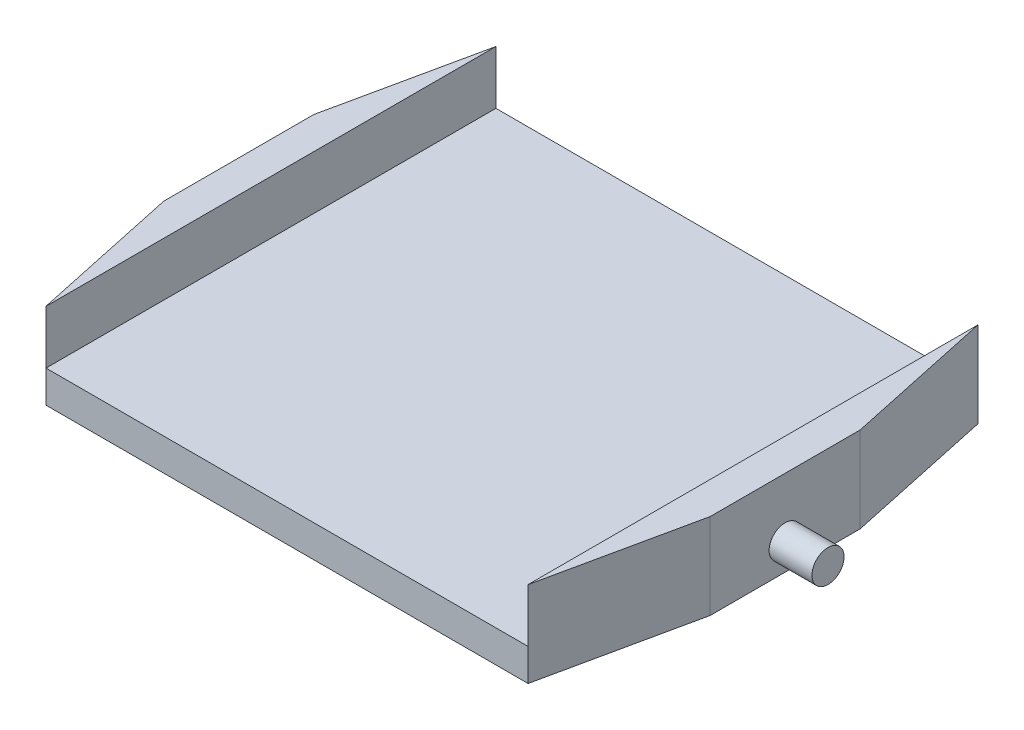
SolidWorks part; units mm, degrees
ref_plane "Front Plane" through (0, 0, 0) normal (0, 0, 1) x (1, 0, 0)
ref_plane "Top Plane" through (0, 0, 0) normal (0, 1, 0) x (1, 0, 0)
ref_plane "Right Plane" through (0, 0, 0) normal (1, 0, 0) x (0, 0, -1)
sketch "Sketch1" plane through (0, 0, 0) normal (0, 1, 0) x (1, 0, 0)
  line L0 (45, 0) -> (48, 14)
  line L1 (0, 0) -> (45, 0)
  line L2 (0, 0) -> (0, 42) construction
  line L3 (0, 42) -> (45, 42)
  line L4 (45, 0) -> (45, 42) construction
  line L5 (48, 14) -> (48, 28)
  line L6 (48, 28) -> (45, 42)
  line L7 (22.5, 42) -> (22.5, 0) construction
  line L8 (-3, 28) -> (0, 42)
  line L9 (-3, 14) -> (-3, 28)
  line L10 (0, 0) -> (-3, 14)
  dimension "D1" = 45
  dimension "D2" = 42
  dimension "D3" = 3
  dimension "D4" = 14
  dimension "D5" = 14
extrude "Boss-Extrude1" add sketch "Sketch1" along normal blind 3
sketch "Sketch2" plane through (0, 3, 0) normal (0, 1, 0) x (1, 0, 0)
  line L0 (0, 42) -> (0, 0)
  line L1 (0, 0) -> (-3, 14)
  line L2 (-3, 14) -> (-3, 28)
  line L3 (-3, 28) -> (0, 42)
  line L4 (45, 42) -> (45, 0)
  line L5 (45, 0) -> (48, 14)
  line L6 (48, 14) -> (48, 28)
  line L7 (48, 28) -> (45, 42)
extrude "Boss-Extrude2" add sketch "Sketch2" along normal blind 5
sketch "Sketch3" plane through (-3, 0, 0) normal (-1, 0, 0) x (0, 0, 1)
  line L0 (-21, 8) -> (-21, 0) construction
  line L1 (-28, 8) -> (-14, 8) construction
  line L2 (-28, 0) -> (-14, 0) construction
  circle A0 centre (-21, 2.5) radius 1.5
  point P8 (0, 0)
  point P9 (0, 0)
  dimension "D1" = 3
  dimension "D2" = 2.5
extrude "Boss-Extrude3" add sketch "Sketch3" along normal blind 4
sketch "Sketch4" plane through (48, 0, 0) normal (1, 0, 0) x (0, 0, -1)
  line L0 (21, 8) -> (21, 0) construction
  line L1 (14, 8) -> (28, 8) construction
  line L2 (14, 0) -> (28, 0) construction
  circle A0 centre (21, 2.5) radius 1.5
  dimension "D1" = 3
  dimension "D2" = 2.5
extrude "Boss-Extrude4" add sketch "Sketch4" along normal blind 4
